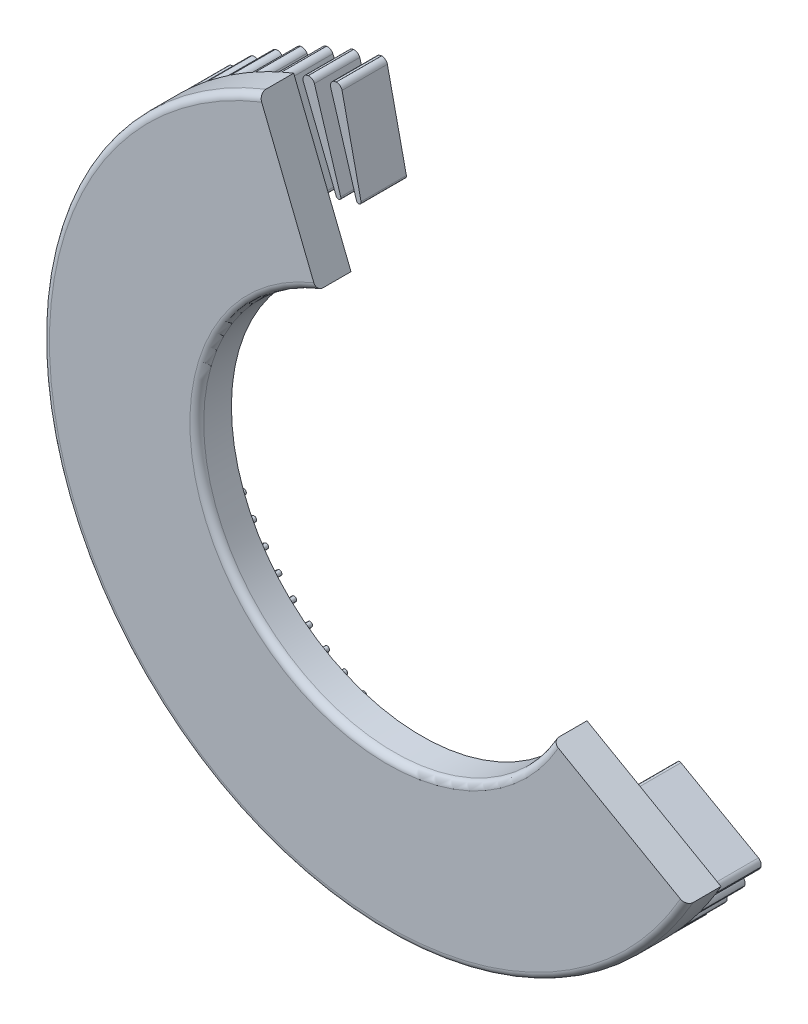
SolidWorks part; units mm, degrees
ref_plane "Přední rovina" through (0, 0, 0) normal (0, 0, 1) x (1, 0, 0)
ref_plane "Horní rovina" through (0, 0, 0) normal (0, 1, 0) x (1, 0, 0)
ref_plane "Pravá rovina" through (0, 0, 0) normal (1, 0, 0) x (0, 0, -1)
sketch "Skica1" plane through (0, 0, 0) normal (0, 0, 1) x (1, 0, 0)
  line L0 (-0.0007, 94.0554) -> (-0.0007, -97.5291) construction
  line L1 (-111.4898, -0.3887) -> (131.9321, -0.3887) construction
  line L2 (-0.0007, 77.5113) -> (-0.0007, 75.9876)
  line L3 (-0.3207, 75.9876) -> (0.3193, 75.9876)
  line L4 (0.3193, 75.9876) -> (0.3193, 75.9776)
  line L5 (-0.0007, 76.1476) -> (-0.0007, 74.7176)
  line L6 (-0.0007, 74.7176) -> (-0.0007, 55.1176)
  line L7 (1.2993, 74.7176) -> (0.5293, 55.1176)
  line L8 (-1.3007, 74.7176) -> (-0.5307, 55.1176)
  line L9 (-0.3207, 75.9876) -> (-0.3207, 75.9776)
  line L10 (5.0405, 74.5587) -> (4.1455, 54.964)
  line L11 (7.6311, 74.3382) -> (5.2017, 54.8742)
  line L12 (6.7624, 75.6868) -> (6.7615, 75.6768)
  line L13 (6.1247, 75.7411) -> (6.1238, 75.7311)
  line L14 (6.1247, 75.7411) -> (6.7624, 75.6868)
  line L15 (11.3454, 73.8627) -> (8.7919, 54.4145)
  line L16 (13.908, 73.4233) -> (9.8366, 54.2353)
  line L17 (13.1567, 74.8406) -> (13.155, 74.8308)
  line L18 (12.5259, 74.9488) -> (12.5242, 74.9389)
  line L19 (12.5259, 74.9488) -> (13.1567, 74.8406)
  line L20 (17.5685, 72.6344) -> (13.3749, 53.4728)
  line L21 (20.0846, 71.9793) -> (14.4007, 53.2057)
  line L22 (19.4562, 73.4552) -> (19.4537, 73.4456)
  line L23 (18.8369, 73.6165) -> (18.8344, 73.6068)
  line L24 (18.8369, 73.6165) -> (19.4562, 73.4552)
  line L25 (23.665, 70.8829) -> (17.8615, 52.1459)
  line L26 (26.1165, 70.0167) -> (18.861, 51.7928)
  line L27 (25.6156, 71.5406) -> (25.6123, 71.5312)
  line L28 (25.0121, 71.7538) -> (25.0088, 71.7444)
  line L29 (25.0121, 71.7538) -> (25.6156, 71.5406)
  line L30 (29.5911, 68.6206) -> (22.2194, 50.4433)
  line L31 (31.9603, 67.5496) -> (23.1854, 50.0067)
  line L32 (31.5904, 69.1105) -> (31.5863, 69.1014)
  line L33 (31.0072, 69.3742) -> (31.0031, 69.365)
  line L34 (31.0072, 69.3742) -> (31.5904, 69.1105)
  line L35 (35.3039, 65.8639) -> (26.4173, 48.3773)
  line L36 (37.5737, 64.5958) -> (27.3427, 47.8603)
  line L37 (37.3376, 66.1825) -> (37.3327, 66.1738)
  line L38 (36.7788, 66.4946) -> (36.7739, 66.4859)
  line L39 (36.7788, 66.4946) -> (37.3376, 66.1825)
  line L40 (40.7624, 62.6326) -> (30.4248, 45.9626)
  line L41 (42.9165, 61.1767) -> (31.303, 45.3691)
  line L42 (42.8157, 62.7776) -> (42.8101, 62.7694)
  line L43 (42.2855, 63.136) -> (42.2799, 63.1277)
  line L44 (42.2855, 63.136) -> (42.8157, 62.7776)
  line L45 (45.9271, 58.9501) -> (34.2131, 43.2168)
  line L46 (47.95, 57.3167) -> (35.0378, 42.5509)
  line L47 (47.9854, 58.9205) -> (47.9791, 58.9127)
  line L48 (47.4874, 59.3225) -> (47.4812, 59.3147)
  line L49 (47.4874, 59.3225) -> (47.9854, 58.9205)
  line L50 (50.761, 54.8428) -> (37.7549, 40.1597)
  line L51 (52.6381, 53.0438) -> (38.5202, 39.4262)
  line L52 (52.8093, 54.6388) -> (52.8024, 54.6315)
  line L53 (52.3473, 55.0816) -> (52.3403, 55.0744)
  line L54 (52.3473, 55.0816) -> (52.8093, 54.6388)
  line L55 (55.2291, 50.3404) -> (41.0247, 36.8132)
  line L56 (56.9469, 48.3887) -> (41.725, 36.0175)
  line L57 (57.2528, 49.9634) -> (57.2453, 49.9568)
  line L58 (56.8299, 50.4438) -> (56.8224, 50.4372)
  line L59 (56.8299, 50.4438) -> (57.2528, 49.9634)
  line L60 (59.2993, 45.4753) -> (43.9988, 33.2014)
  line L61 (60.8454, 43.3849) -> (44.6292, 32.3492)
  line L62 (61.2837, 44.928) -> (61.2757, 44.9221)
  line L63 (60.9031, 45.4426) -> (60.8951, 45.4366)
  line L64 (60.9031, 45.4426) -> (61.2837, 44.928)
  line L65 (62.9423, 40.2825) -> (46.656, 29.3504)
  line L66 (64.3055, 38.0686) -> (47.2118, 28.4478)
  line L67 (64.8731, 39.5689) -> (64.8646, 39.5637)
  line L68 (64.5375, 40.1139) -> (64.529, 40.1087)
  line L69 (64.5375, 40.1139) -> (64.8731, 39.5689)
  line L70 (66.1317, 34.7995) -> (48.977, 25.288)
  line L71 (67.3022, 32.4779) -> (49.4542, 24.3415)
  line L72 (67.9951, 33.9248) -> (67.9861, 33.9203)
  line L73 (67.7069, 34.4962) -> (67.698, 34.4917)
  line L74 (67.7069, 34.4962) -> (67.9951, 33.9248)
  line L75 (68.8447, 29.0658) -> (50.9452, 21.0434)
  line L76 (69.8141, 26.6533) -> (51.3404, 20.0598)
  line L77 (70.6271, 28.0362) -> (70.6179, 28.0324)
  line L78 (70.3885, 28.63) -> (70.3792, 28.6263)
  line L79 (70.3885, 28.63) -> (70.6271, 28.0362)
  line L80 (71.0616, 23.1227) -> (52.5462, 16.6471)
  line L81 (71.823, 20.6366) -> (52.8566, 15.6336)
  line L82 (72.7503, 21.9456) -> (72.7408, 21.9426)
  line L83 (72.5629, 22.5575) -> (72.5534, 22.5546)
  line L84 (72.5629, 22.5575) -> (72.7503, 21.9456)
  line L85 (72.7666, 17.0129) -> (53.7687, 12.1309)
  line L86 (73.3143, 14.4713) -> (53.992, 11.0947)
  line L87 (74.3494, 15.6969) -> (74.3396, 15.6947)
  line L88 (74.2145, 16.3225) -> (74.2047, 16.3204)
  line L89 (74.2145, 16.3225) -> (74.3494, 15.6969)
  line L90 (73.9472, 10.7806) -> (54.6038, 7.5273)
  line L91 (74.2775, 8.2017) -> (54.7384, 6.4759)
  line L92 (75.4127, 9.335) -> (75.4028, 9.3338)
  line L93 (75.3314, 9.9699) -> (75.3215, 9.9686)
  line L94 (75.3314, 9.9699) -> (75.4127, 9.335)
  line L95 (74.5951, 4.4706) -> (55.0454, 2.8695)
  line L96 (74.7054, 1.8729) -> (55.0904, 1.8104)
  line L97 (75.9327, 2.906) -> (75.9227, 2.9055)
  line L98 (75.9055, 3.5454) -> (75.8955, 3.545)
  line L99 (75.9055, 3.5454) -> (75.9327, 2.906)
  line L100 (74.7055, -1.8716) -> (55.0905, -1.8091)
  line L101 (74.5951, -4.4693) -> (55.0455, -2.8681)
  line L102 (75.9056, -3.544) -> (75.8956, -3.5436)
  line L103 (75.9327, -2.9046) -> (75.9228, -2.9042)
  line L104 (75.9327, -2.9046) -> (75.9056, -3.544)
  line L105 (74.2776, -8.2003) -> (54.7386, -6.4745)
  line L106 (73.9474, -10.7793) -> (54.6039, -7.526)
  line L107 (75.3316, -9.9685) -> (75.3217, -9.9673)
  line L108 (75.4129, -9.3337) -> (75.403, -9.3324)
  line L109 (75.4129, -9.3337) -> (75.3316, -9.9685)
  line L110 (73.3146, -14.47) -> (53.9923, -11.0934)
  line L111 (72.7668, -17.0116) -> (53.769, -12.1296)
  line L112 (74.2148, -16.3212) -> (74.205, -16.3191)
  line L113 (74.3496, -15.6955) -> (74.3399, -15.6934)
  line L114 (74.3496, -15.6955) -> (74.2148, -16.3212)
  line L115 (71.8234, -20.6354) -> (52.857, -15.6323)
  line L116 (71.062, -23.1214) -> (52.5466, -16.6458)
  line L117 (72.5633, -22.5562) -> (72.5538, -22.5533)
  line L118 (72.7507, -21.9443) -> (72.7412, -21.9414)
  line L119 (72.7507, -21.9443) -> (72.5633, -22.5562)
  line L120 (69.8146, -26.6521) -> (51.3409, -20.0586)
  line L121 (68.8452, -29.0646) -> (50.9457, -21.0421)
  line L122 (70.389, -28.6288) -> (70.3797, -28.625)
  line L123 (70.6276, -28.0349) -> (70.6184, -28.0312)
  line L124 (70.6276, -28.0349) -> (70.389, -28.6288)
  line L125 (67.3029, -32.4767) -> (49.4548, -24.3403)
  line L126 (66.1323, -34.7984) -> (48.9776, -25.2868)
  line L127 (67.7075, -34.495) -> (67.6986, -34.4905)
  line L128 (67.9957, -33.9236) -> (67.9867, -33.9191)
  line L129 (67.9957, -33.9236) -> (67.7075, -34.495)
  line L130 (64.3062, -38.0674) -> (47.2125, -28.4467)
  line L131 (62.943, -40.2814) -> (46.6567, -29.3493)
  line L132 (64.5382, -40.1128) -> (64.5297, -40.1075)
  line L133 (64.8738, -39.5678) -> (64.8653, -39.5626)
  line L134 (64.8738, -39.5678) -> (64.5382, -40.1128)
  line L135 (60.8462, -43.3838) -> (44.63, -32.3481)
  line L136 (59.3001, -45.4742) -> (43.9996, -33.2003)
  line L137 (60.9039, -45.4415) -> (60.8959, -45.4355)
  line L138 (61.2845, -44.9269) -> (61.2765, -44.921)
  line L139 (61.2845, -44.9269) -> (60.9039, -45.4415)
  line L140 (56.9478, -48.3877) -> (41.7259, -36.0165)
  line L141 (55.23, -50.3394) -> (41.0255, -36.8122)
  line L142 (56.8308, -50.4428) -> (56.8233, -50.4362)
  line L143 (57.2537, -49.9624) -> (57.2461, -49.9558)
  line L144 (57.2537, -49.9624) -> (56.8308, -50.4428)
  line L145 (52.639, -53.0428) -> (38.5211, -39.4253)
  line L146 (50.762, -54.8419) -> (37.7559, -40.1588)
  line L147 (52.3482, -55.0807) -> (52.3413, -55.0735)
  line L148 (52.8103, -54.6378) -> (52.8034, -54.6306)
  line L149 (52.8103, -54.6378) -> (52.3482, -55.0807)
  line L150 (47.9511, -57.3159) -> (35.0389, -42.5501)
  line L151 (45.9282, -58.9492) -> (34.2141, -43.216)
  line L152 (47.4885, -59.3217) -> (47.4822, -59.3139)
  line L153 (47.9864, -58.9196) -> (47.9801, -58.9118)
  line L154 (47.9864, -58.9196) -> (47.4885, -59.3217)
  line L155 (42.9176, -61.1759) -> (31.3041, -45.3683)
  line L156 (40.7635, -62.6319) -> (30.4259, -45.9619)
  line L157 (42.2866, -63.1353) -> (42.281, -63.127)
  line L158 (42.8168, -62.7769) -> (42.8112, -62.7686)
  line L159 (42.8168, -62.7769) -> (42.2866, -63.1353)
  line L160 (37.5749, -64.5952) -> (27.3439, -47.8596)
  line L161 (35.3051, -65.8632) -> (26.4185, -48.3766)
  line L162 (36.78, -66.494) -> (36.7751, -66.4853)
  line L163 (37.3387, -66.1819) -> (37.3338, -66.1731)
  line L164 (37.3387, -66.1819) -> (36.78, -66.494)
  line L165 (31.9615, -67.5491) -> (23.1866, -50.0062)
  line L166 (29.5923, -68.62) -> (22.2207, -50.4428)
  line L167 (31.0084, -69.3736) -> (31.0043, -69.3645)
  line L168 (31.5916, -69.11) -> (31.5875, -69.1009)
  line L169 (31.5916, -69.11) -> (31.0084, -69.3736)
  line L170 (26.1178, -70.0162) -> (18.8622, -51.7924)
  line L171 (23.6663, -70.8824) -> (17.8628, -52.1455)
  line L172 (25.0134, -71.7534) -> (25.0101, -71.744)
  line L173 (25.6168, -71.5402) -> (25.6135, -71.5307)
  line L174 (25.6168, -71.5402) -> (25.0134, -71.7534)
  line L175 (20.0859, -71.9789) -> (14.402, -53.2054)
  line L176 (17.5698, -72.6341) -> (13.3762, -53.4725)
  line L177 (18.8382, -73.6162) -> (18.8357, -73.6065)
  line L178 (19.4575, -73.4549) -> (19.455, -73.4452)
  line L179 (19.4575, -73.4549) -> (18.8382, -73.6162)
  line L180 (13.9093, -73.423) -> (9.838, -54.2351)
  line L181 (11.3467, -73.8625) -> (8.7932, -54.4142)
  line L182 (12.5272, -74.9486) -> (12.5255, -74.9387)
  line L183 (13.158, -74.8404) -> (13.1563, -74.8305)
  line L184 (13.158, -74.8404) -> (12.5272, -74.9486)
  line L185 (7.6325, -74.3381) -> (5.2031, -54.874)
  line L186 (5.0418, -74.5586) -> (4.1469, -54.9639)
  line L187 (6.126, -75.7409) -> (6.1252, -75.731)
  line L188 (6.7637, -75.6867) -> (6.7629, -75.6767)
  line L189 (6.7637, -75.6867) -> (6.126, -75.7409)
  line L190 (1.3007, -74.7176) -> (0.5307, -55.1176)
  line L191 (-1.2993, -74.7176) -> (-0.5293, -55.1176)
  line L192 (-0.3193, -75.9876) -> (-0.3193, -75.9776)
  line L193 (0.3207, -75.9876) -> (0.3207, -75.9776)
  line L194 (0.3207, -75.9876) -> (-0.3193, -75.9876)
  line L195 (-5.0405, -74.5587) -> (-4.1455, -54.964)
  line L196 (-7.6311, -74.3382) -> (-5.2017, -54.8742)
  line L197 (-6.7624, -75.6868) -> (-6.7615, -75.6768)
  line L198 (-6.1247, -75.7411) -> (-6.1238, -75.7311)
  line L199 (-6.1247, -75.7411) -> (-6.7624, -75.6868)
  line L200 (-11.3454, -73.8627) -> (-8.7919, -54.4145)
  line L201 (-13.908, -73.4233) -> (-9.8366, -54.2353)
  line L202 (-13.1567, -74.8406) -> (-13.155, -74.8308)
  line L203 (-12.5259, -74.9488) -> (-12.5242, -74.9389)
  line L204 (-12.5259, -74.9488) -> (-13.1567, -74.8406)
  line L205 (-17.5685, -72.6344) -> (-13.3749, -53.4728)
  line L206 (-20.0846, -71.9793) -> (-14.4007, -53.2057)
  line L207 (-19.4562, -73.4552) -> (-19.4537, -73.4456)
  line L208 (-18.8369, -73.6165) -> (-18.8344, -73.6068)
  line L209 (-18.8369, -73.6165) -> (-19.4562, -73.4552)
  line L210 (-23.665, -70.8829) -> (-17.8615, -52.1459)
  line L211 (-26.1165, -70.0167) -> (-18.861, -51.7928)
  line L212 (-25.6156, -71.5406) -> (-25.6123, -71.5312)
  line L213 (-25.0121, -71.7538) -> (-25.0088, -71.7444)
  line L214 (-25.0121, -71.7538) -> (-25.6156, -71.5406)
  line L215 (-29.5911, -68.6206) -> (-22.2194, -50.4433)
  line L216 (-31.9603, -67.5496) -> (-23.1854, -50.0067)
  line L217 (-31.5904, -69.1105) -> (-31.5863, -69.1014)
  line L218 (-31.0072, -69.3742) -> (-31.0031, -69.365)
  line L219 (-31.0072, -69.3742) -> (-31.5904, -69.1105)
  line L220 (-35.3039, -65.8639) -> (-26.4173, -48.3773)
  line L221 (-37.5737, -64.5958) -> (-27.3427, -47.8603)
  line L222 (-37.3376, -66.1825) -> (-37.3327, -66.1738)
  line L223 (-36.7788, -66.4946) -> (-36.7739, -66.4859)
  line L224 (-36.7788, -66.4946) -> (-37.3376, -66.1825)
  line L225 (-40.7624, -62.6326) -> (-30.4248, -45.9626)
  line L226 (-42.9165, -61.1767) -> (-31.303, -45.3691)
  line L227 (-42.8157, -62.7776) -> (-42.8101, -62.7694)
  line L228 (-42.2855, -63.136) -> (-42.2799, -63.1277)
  line L229 (-42.2855, -63.136) -> (-42.8157, -62.7776)
  line L230 (-45.9271, -58.9501) -> (-34.2131, -43.2168)
  line L231 (-47.95, -57.3167) -> (-35.0378, -42.5509)
  line L232 (-47.9854, -58.9205) -> (-47.9791, -58.9127)
  line L233 (-47.4874, -59.3225) -> (-47.4812, -59.3147)
  line L234 (-47.4874, -59.3225) -> (-47.9854, -58.9205)
  line L235 (-50.761, -54.8428) -> (-37.7549, -40.1597)
  line L236 (-52.6381, -53.0438) -> (-38.5202, -39.4262)
  line L237 (-52.8093, -54.6388) -> (-52.8024, -54.6315)
  line L238 (-52.3473, -55.0816) -> (-52.3403, -55.0744)
  line L239 (-52.3473, -55.0816) -> (-52.8093, -54.6388)
  line L240 (-55.2291, -50.3404) -> (-41.0247, -36.8132)
  line L241 (-56.9469, -48.3887) -> (-41.725, -36.0175)
  line L242 (-57.2528, -49.9634) -> (-57.2453, -49.9568)
  line L243 (-56.8299, -50.4438) -> (-56.8224, -50.4372)
  line L244 (-56.8299, -50.4438) -> (-57.2528, -49.9634)
  line L245 (-59.2993, -45.4753) -> (-43.9988, -33.2014)
  line L246 (-60.8454, -43.3849) -> (-44.6292, -32.3492)
  line L247 (-61.2837, -44.928) -> (-61.2757, -44.9221)
  line L248 (-60.9031, -45.4426) -> (-60.8951, -45.4366)
  line L249 (-60.9031, -45.4426) -> (-61.2837, -44.928)
  line L250 (-62.9423, -40.2825) -> (-46.656, -29.3504)
  line L251 (-64.3055, -38.0686) -> (-47.2118, -28.4478)
  line L252 (-64.8731, -39.5689) -> (-64.8646, -39.5637)
  line L253 (-64.5375, -40.1139) -> (-64.529, -40.1087)
  line L254 (-64.5375, -40.1139) -> (-64.8731, -39.5689)
  line L255 (-66.1317, -34.7995) -> (-48.977, -25.288)
  line L256 (-67.3022, -32.4779) -> (-49.4542, -24.3415)
  line L257 (-67.9951, -33.9248) -> (-67.9861, -33.9203)
  line L258 (-67.7069, -34.4962) -> (-67.698, -34.4917)
  line L259 (-67.7069, -34.4962) -> (-67.9951, -33.9248)
  line L260 (-68.8447, -29.0658) -> (-50.9452, -21.0434)
  line L261 (-69.8141, -26.6533) -> (-51.3404, -20.0598)
  line L262 (-70.6271, -28.0362) -> (-70.6179, -28.0324)
  line L263 (-70.3885, -28.63) -> (-70.3792, -28.6263)
  line L264 (-70.3885, -28.63) -> (-70.6271, -28.0362)
  line L265 (-71.0616, -23.1227) -> (-52.5462, -16.6471)
  line L266 (-71.823, -20.6366) -> (-52.8566, -15.6336)
  line L267 (-72.7503, -21.9456) -> (-72.7408, -21.9426)
  line L268 (-72.5629, -22.5575) -> (-72.5534, -22.5546)
  line L269 (-72.5629, -22.5575) -> (-72.7503, -21.9456)
  line L270 (-72.7666, -17.0129) -> (-53.7687, -12.1309)
  line L271 (-73.3143, -14.4713) -> (-53.992, -11.0947)
  line L272 (-74.3494, -15.6969) -> (-74.3396, -15.6947)
  line L273 (-74.2145, -16.3225) -> (-74.2047, -16.3204)
  line L274 (-74.2145, -16.3225) -> (-74.3494, -15.6969)
  line L275 (-73.9472, -10.7806) -> (-54.6038, -7.5273)
  line L276 (-74.2775, -8.2017) -> (-54.7384, -6.4759)
  line L277 (-75.4127, -9.335) -> (-75.4028, -9.3338)
  line L278 (-75.3314, -9.9699) -> (-75.3215, -9.9686)
  line L279 (-75.3314, -9.9699) -> (-75.4127, -9.335)
  line L280 (-74.5951, -4.4706) -> (-55.0454, -2.8695)
  line L281 (-74.7054, -1.8729) -> (-55.0904, -1.8104)
  line L282 (-75.9327, -2.906) -> (-75.9227, -2.9055)
  line L283 (-75.9055, -3.5454) -> (-75.8955, -3.545)
  line L284 (-75.9055, -3.5454) -> (-75.9327, -2.906)
  line L285 (-74.7055, 1.8716) -> (-55.0905, 1.8091)
  line L286 (-74.5951, 4.4693) -> (-55.0455, 2.8681)
  line L287 (-75.9056, 3.544) -> (-75.8956, 3.5436)
  line L288 (-75.9327, 2.9046) -> (-75.9228, 2.9042)
  line L289 (-75.9327, 2.9046) -> (-75.9056, 3.544)
  line L290 (-74.2776, 8.2003) -> (-54.7386, 6.4745)
  line L291 (-73.9474, 10.7793) -> (-54.6039, 7.526)
  line L292 (-75.3316, 9.9685) -> (-75.3217, 9.9673)
  line L293 (-75.4129, 9.3337) -> (-75.403, 9.3324)
  line L294 (-75.4129, 9.3337) -> (-75.3316, 9.9685)
  line L295 (-73.3146, 14.47) -> (-53.9923, 11.0934)
  line L296 (-72.7668, 17.0116) -> (-53.769, 12.1296)
  line L297 (-74.2148, 16.3212) -> (-74.205, 16.3191)
  line L298 (-74.3496, 15.6955) -> (-74.3399, 15.6934)
  line L299 (-74.3496, 15.6955) -> (-74.2148, 16.3212)
  line L300 (-71.8234, 20.6354) -> (-52.857, 15.6323)
  line L301 (-71.062, 23.1214) -> (-52.5466, 16.6458)
  line L302 (-72.5633, 22.5562) -> (-72.5538, 22.5533)
  line L303 (-72.7507, 21.9443) -> (-72.7412, 21.9414)
  line L304 (-72.7507, 21.9443) -> (-72.5633, 22.5562)
  line L305 (-69.8146, 26.6521) -> (-51.3409, 20.0586)
  line L306 (-68.8452, 29.0646) -> (-50.9457, 21.0421)
  line L307 (-70.389, 28.6288) -> (-70.3797, 28.625)
  line L308 (-70.6276, 28.0349) -> (-70.6184, 28.0312)
  line L309 (-70.6276, 28.0349) -> (-70.389, 28.6288)
  line L310 (-67.3029, 32.4767) -> (-49.4548, 24.3403)
  line L311 (-66.1323, 34.7984) -> (-48.9776, 25.2868)
  line L312 (-67.7075, 34.495) -> (-67.6986, 34.4905)
  line L313 (-67.9957, 33.9236) -> (-67.9867, 33.9191)
  line L314 (-67.9957, 33.9236) -> (-67.7075, 34.495)
  line L315 (-64.3062, 38.0674) -> (-47.2125, 28.4467)
  line L316 (-62.943, 40.2814) -> (-46.6567, 29.3493)
  line L317 (-64.5382, 40.1128) -> (-64.5297, 40.1075)
  line L318 (-64.8738, 39.5678) -> (-64.8653, 39.5626)
  line L319 (-64.8738, 39.5678) -> (-64.5382, 40.1128)
  line L320 (-60.8462, 43.3838) -> (-44.63, 32.3481)
  line L321 (-59.3001, 45.4742) -> (-43.9996, 33.2003)
  line L322 (-60.9039, 45.4415) -> (-60.8959, 45.4355)
  line L323 (-61.2845, 44.9269) -> (-61.2765, 44.921)
  line L324 (-61.2845, 44.9269) -> (-60.9039, 45.4415)
  line L325 (-56.9478, 48.3877) -> (-41.7259, 36.0165)
  line L326 (-55.23, 50.3394) -> (-41.0255, 36.8122)
  line L327 (-56.8308, 50.4428) -> (-56.8233, 50.4362)
  line L328 (-57.2537, 49.9624) -> (-57.2461, 49.9558)
  line L329 (-57.2537, 49.9624) -> (-56.8308, 50.4428)
  line L330 (-52.639, 53.0428) -> (-38.5211, 39.4253)
  line L331 (-50.762, 54.8419) -> (-37.7559, 40.1588)
  line L332 (-52.3482, 55.0807) -> (-52.3413, 55.0735)
  line L333 (-52.8103, 54.6378) -> (-52.8034, 54.6306)
  line L334 (-52.8103, 54.6378) -> (-52.3482, 55.0807)
  line L335 (-47.9511, 57.3159) -> (-35.0389, 42.5501)
  line L336 (-45.9282, 58.9492) -> (-34.2141, 43.216)
  line L337 (-47.4885, 59.3217) -> (-47.4822, 59.3139)
  line L338 (-47.9864, 58.9196) -> (-47.9801, 58.9118)
  line L339 (-47.9864, 58.9196) -> (-47.4885, 59.3217)
  line L340 (-42.9176, 61.1759) -> (-31.3041, 45.3683)
  line L341 (-40.7635, 62.6319) -> (-30.4259, 45.9619)
  line L342 (-42.2866, 63.1353) -> (-42.281, 63.127)
  line L343 (-42.8168, 62.7769) -> (-42.8112, 62.7686)
  line L344 (-42.8168, 62.7769) -> (-42.2866, 63.1353)
  line L345 (-37.5749, 64.5952) -> (-27.3439, 47.8596)
  line L346 (-35.3051, 65.8632) -> (-26.4185, 48.3766)
  line L347 (-36.78, 66.494) -> (-36.7751, 66.4853)
  line L348 (-37.3387, 66.1819) -> (-37.3338, 66.1731)
  line L349 (-37.3387, 66.1819) -> (-36.78, 66.494)
  line L350 (-31.9615, 67.5491) -> (-23.1866, 50.0062)
  line L351 (-29.5923, 68.62) -> (-22.2207, 50.4428)
  line L352 (-31.0084, 69.3736) -> (-31.0043, 69.3645)
  line L353 (-31.5916, 69.11) -> (-31.5875, 69.1009)
  line L354 (-31.5916, 69.11) -> (-31.0084, 69.3736)
  line L355 (-26.1178, 70.0162) -> (-18.8622, 51.7924)
  line L356 (-23.6663, 70.8824) -> (-17.8628, 52.1455)
  line L357 (-25.0134, 71.7534) -> (-25.0101, 71.744)
  line L358 (-25.6168, 71.5402) -> (-25.6135, 71.5307)
  line L359 (-25.6168, 71.5402) -> (-25.0134, 71.7534)
  line L360 (-20.0859, 71.9789) -> (-14.402, 53.2054)
  line L361 (-17.5698, 72.6341) -> (-13.3762, 53.4725)
  line L362 (-18.8382, 73.6162) -> (-18.8357, 73.6065)
  line L363 (-19.4575, 73.4549) -> (-19.455, 73.4452)
  line L364 (-19.4575, 73.4549) -> (-18.8382, 73.6162)
  line L365 (-13.9093, 73.423) -> (-9.838, 54.2351)
  line L366 (-11.3467, 73.8625) -> (-8.7932, 54.4142)
  line L367 (-12.5272, 74.9486) -> (-12.5255, 74.9387)
  line L368 (-13.158, 74.8404) -> (-13.1563, 74.8305)
  line L369 (-13.158, 74.8404) -> (-12.5272, 74.9486)
  line L370 (-7.6325, 74.3381) -> (-5.2031, 54.874)
  line L371 (-5.0418, 74.5586) -> (-4.1469, 54.9639)
  line L372 (-6.126, 75.7409) -> (-6.1252, 75.731)
  line L373 (-6.7637, 75.6867) -> (-6.7629, 75.6767)
  line L374 (-6.7637, 75.6867) -> (-6.126, 75.7409)
  circle A0 centre (-0.0007, -0.3887) radius 25
  circle A1 centre (-0.0007, -0.3887) radius 77.9
  arc A2 (1.2953, 74.6156) -> (0.3193, 75.9776) centre (-0.0007, 74.7176) ccw
  arc A3 (-0.5307, 55.1176) -> (0.5293, 55.1176) centre (-0.0007, 55.1176) ccw
  arc A4 (-0.3207, 75.9776) -> (-1.2967, 74.6156) centre (-0.0007, 74.7176) ccw
  arc A5 (4.1455, 54.964) -> (5.2017, 54.8742) centre (4.6736, 54.9191) ccw
  arc A6 (6.1238, 75.7311) -> (5.0359, 74.4568) centre (6.3358, 74.4485) ccw
  arc A7 (7.6185, 74.237) -> (6.7615, 75.6768) centre (6.3358, 74.4485) ccw
  arc A8 (8.7919, 54.4145) -> (9.8366, 54.2353) centre (9.3143, 54.3249) ccw
  arc A9 (12.5242, 74.9389) -> (11.3321, 73.7615) centre (12.6267, 73.643) ccw
  arc A10 (13.8868, 73.3234) -> (13.155, 74.8308) centre (12.6267, 73.643) ccw
  arc A11 (13.3749, 53.4728) -> (14.4007, 53.2057) centre (13.8878, 53.3393) ccw
  arc A12 (18.8344, 73.6068) -> (17.5467, 72.5347) centre (18.8265, 72.3069) ccw
  arc A13 (20.055, 71.8816) -> (19.4537, 73.4456) centre (18.8265, 72.3069) ccw
  arc A14 (17.8615, 52.1459) -> (18.861, 51.7928) centre (18.3612, 51.9694) ccw
  arc A15 (25.0088, 71.7444) -> (23.6348, 70.7854) centre (24.8908, 70.4498) ccw
  arc A16 (26.0788, 69.9219) -> (25.6123, 71.5312) centre (24.8908, 70.4498) ccw
  arc A17 (22.2194, 50.4433) -> (23.1854, 50.0067) centre (22.7024, 50.225) ccw
  arc A18 (31.0031, 69.365) -> (29.5527, 68.526) centre (30.7757, 68.0851) ccw
  arc A19 (31.9146, 67.4583) -> (31.5863, 69.1014) centre (30.7757, 68.0851) ccw
  arc A20 (26.4173, 48.3773) -> (27.3427, 47.8603) centre (26.88, 48.1188) ccw
  arc A21 (36.7739, 66.4859) -> (35.2577, 65.7729) centre (36.4388, 65.2299) ccw
  arc A22 (37.5205, 64.5088) -> (37.3327, 66.1738) centre (36.4388, 65.2299) ccw
  arc A23 (30.4248, 45.9626) -> (31.303, 45.3691) centre (30.8639, 45.6658) ccw
  arc A24 (42.2799, 63.1277) -> (40.7086, 62.5459) centre (41.8394, 61.9046) ccw
  arc A25 (42.8561, 61.0944) -> (42.8101, 62.7694) centre (41.8394, 61.9046) ccw
  arc A26 (34.2131, 43.2168) -> (35.0378, 42.5509) centre (34.6255, 42.8839) ccw
  arc A27 (47.4812, 59.3147) -> (45.8662, 58.8682) centre (46.9386, 58.1334) ccw
  arc A28 (47.8828, 57.2399) -> (47.9791, 58.9127) centre (46.9386, 58.1334) ccw
  arc A29 (37.7549, 40.1597) -> (38.5202, 39.4262) centre (38.1375, 39.793) ccw
  arc A30 (52.3403, 55.0744) -> (50.6933, 54.7664) centre (51.6995, 53.9433) ccw
  arc A31 (52.5646, 52.9729) -> (52.8024, 54.6315) centre (51.6995, 53.9433) ccw
  arc A32 (41.0247, 36.8132) -> (41.725, 36.0175) centre (41.3748, 36.4153) ccw
  arc A33 (56.8224, 50.4372) -> (55.1552, 50.27) centre (56.088, 49.3645) ccw
  arc A34 (56.8677, 48.3243) -> (57.2453, 49.9568) centre (56.088, 49.3645) ccw
  arc A35 (43.9988, 33.2014) -> (44.6292, 32.3492) centre (44.314, 32.7753) ccw
  arc A36 (60.8951, 45.4366) -> (59.2197, 45.4114) centre (60.0723, 44.4301) ccw
  arc A37 (60.761, 43.3275) -> (61.2757, 44.9221) centre (60.0723, 44.4301) ccw
  arc A38 (46.656, 29.3504) -> (47.2118, 28.4478) centre (46.9339, 28.8991) ccw
  arc A39 (64.529, 40.1087) -> (62.8575, 40.2257) centre (63.6239, 39.1756) ccw
  arc A40 (64.2165, 38.0185) -> (64.8646, 39.5637) centre (63.6239, 39.1756) ccw
  arc A41 (48.977, 25.288) -> (49.4542, 24.3415) centre (49.2156, 24.8148) ccw
  arc A42 (67.698, 34.4917) -> (66.0425, 34.7501) centre (66.717, 33.6387) ccw
  arc A43 (67.2094, 32.4356) -> (67.9861, 33.9203) centre (66.717, 33.6387) ccw
  arc A44 (50.9452, 21.0434) -> (51.3404, 20.0598) centre (51.1428, 20.5516) ccw
  arc A45 (70.3792, 28.6263) -> (68.7515, 29.0241) centre (69.3294, 27.8596) ccw
  arc A46 (69.718, 26.619) -> (70.6179, 28.0324) centre (69.3294, 27.8596) ccw
  arc A47 (52.5462, 16.6471) -> (52.8566, 15.6336) centre (52.7014, 16.1403) ccw
  arc A48 (72.5534, 22.5546) -> (70.9653, 23.089) centre (71.4423, 21.8797) ccw
  arc A49 (71.7243, 20.6106) -> (72.7408, 21.9426) centre (71.4423, 21.8797) ccw
  arc A50 (53.7687, 12.1309) -> (53.992, 11.0947) centre (53.8804, 11.6128) ccw
  arc A51 (74.2047, 16.3204) -> (72.6677, 16.9875) centre (73.0404, 15.7421) ccw
  arc A52 (73.2138, 14.4537) -> (74.3396, 15.6947) centre (73.0404, 15.7421) ccw
  arc A53 (54.6038, 7.5273) -> (54.7384, 6.4759) centre (54.6711, 7.0016) ccw
  arc A54 (75.3215, 9.9686) -> (73.8466, 10.7637) centre (74.1123, 9.4911) ccw
  arc A55 (74.1758, 8.1927) -> (75.4028, 9.3338) centre (74.1123, 9.4911) ccw
  arc A56 (55.0454, 2.8695) -> (55.0904, 1.8104) centre (55.0679, 2.3399) ccw
  arc A57 (75.8955, 3.545) -> (74.4934, 4.4623) centre (74.6503, 3.1718) ccw
  arc A58 (74.6034, 1.8726) -> (75.9227, 2.9055) centre (74.6503, 3.1718) ccw
  arc A59 (55.0905, -1.8091) -> (55.0455, -2.8681) centre (55.068, -2.3386) ccw
  arc A60 (75.9228, -2.9042) -> (74.6034, -1.8713) centre (74.6503, -3.1704) ccw
  arc A61 (74.4934, -4.4609) -> (75.8956, -3.5436) centre (74.6503, -3.1704) ccw
  arc A62 (54.7386, -6.4745) -> (54.6039, -7.526) centre (54.6713, -7.0003) ccw
  arc A63 (75.403, -9.3324) -> (74.176, -8.1914) centre (74.1125, -9.4898) ccw
  arc A64 (73.8467, -10.7623) -> (75.3217, -9.9673) centre (74.1125, -9.4898) ccw
  arc A65 (53.9923, -11.0934) -> (53.769, -12.1296) centre (53.8806, -11.6115) ccw
  arc A66 (74.3399, -15.6934) -> (73.2141, -14.4524) centre (73.0407, -15.7408) ccw
  arc A67 (72.668, -16.9862) -> (74.205, -16.3191) centre (73.0407, -15.7408) ccw
  arc A68 (52.857, -15.6323) -> (52.5466, -16.6458) centre (52.7018, -16.139) ccw
  arc A69 (72.7412, -21.9414) -> (71.7247, -20.6093) centre (71.4427, -21.8784) ccw
  arc A70 (70.9657, -23.0877) -> (72.5538, -22.5533) centre (71.4427, -21.8784) ccw
  arc A71 (51.3409, -20.0586) -> (50.9457, -21.0421) centre (51.1433, -20.5503) ccw
  arc A72 (70.6184, -28.0312) -> (69.7185, -26.6178) centre (69.3299, -27.8583) ccw
  arc A73 (68.752, -29.0228) -> (70.3797, -28.625) centre (69.3299, -27.8583) ccw
  arc A74 (49.4548, -24.3403) -> (48.9776, -25.2868) centre (49.2162, -24.8136) ccw
  arc A75 (67.9867, -33.9191) -> (67.21, -32.4344) centre (66.7176, -33.6375) ccw
  arc A76 (66.0431, -34.7489) -> (67.6986, -34.4905) centre (66.7176, -33.6375) ccw
  arc A77 (47.2125, -28.4467) -> (46.6567, -29.3493) centre (46.9346, -28.898) ccw
  arc A78 (64.8653, -39.5626) -> (64.2172, -38.0174) centre (63.6246, -39.1744) ccw
  arc A79 (62.8582, -40.2245) -> (64.5297, -40.1075) centre (63.6246, -39.1744) ccw
  arc A80 (44.63, -32.3481) -> (43.9996, -33.2003) centre (44.3148, -32.7742) ccw
  arc A81 (61.2765, -44.921) -> (60.7618, -43.3264) centre (60.0731, -44.429) ccw
  arc A82 (59.2205, -45.4104) -> (60.8959, -45.4355) centre (60.0731, -44.429) ccw
  arc A83 (41.7259, -36.0165) -> (41.0255, -36.8122) centre (41.3757, -36.4143) ccw
  arc A84 (57.2461, -49.9558) -> (56.8686, -48.3233) centre (56.0889, -49.3635) ccw
  arc A85 (55.1561, -50.269) -> (56.8233, -50.4362) centre (56.0889, -49.3635) ccw
  arc A86 (38.5211, -39.4253) -> (37.7559, -40.1588) centre (38.1385, -39.792) ccw
  arc A87 (52.8034, -54.6306) -> (52.5656, -52.972) centre (51.7005, -53.9424) ccw
  arc A88 (50.6943, -54.7655) -> (52.3413, -55.0735) centre (51.7005, -53.9424) ccw
  arc A89 (35.0389, -42.5501) -> (34.2141, -43.216) centre (34.6265, -42.883) ccw
  arc A90 (47.9801, -58.9118) -> (47.8839, -57.239) centre (46.9396, -58.1325) ccw
  arc A91 (45.8672, -58.8674) -> (47.4822, -59.3139) centre (46.9396, -58.1325) ccw
  arc A92 (31.3041, -45.3683) -> (30.4259, -45.9619) centre (30.865, -45.6651) ccw
  arc A93 (42.8112, -62.7686) -> (42.8572, -61.0937) centre (41.8405, -61.9039) ccw
  arc A94 (40.7097, -62.5451) -> (42.281, -63.127) centre (41.8405, -61.9039) ccw
  arc A95 (27.3439, -47.8596) -> (26.4185, -48.3766) centre (26.8812, -48.1181) ccw
  arc A96 (37.3338, -66.1731) -> (37.5217, -64.5081) centre (36.44, -65.2292) ccw
  arc A97 (35.2588, -65.7722) -> (36.7751, -66.4853) centre (36.44, -65.2292) ccw
  arc A98 (23.1866, -50.0062) -> (22.2207, -50.4428) centre (22.7036, -50.2245) ccw
  arc A99 (31.5875, -69.1009) -> (31.9158, -67.4578) centre (30.7769, -68.0845) ccw
  arc A100 (29.5539, -68.5254) -> (31.0043, -69.3645) centre (30.7769, -68.0845) ccw
  arc A101 (18.8622, -51.7924) -> (17.8628, -52.1455) centre (18.3625, -51.9689) ccw
  arc A102 (25.6135, -71.5307) -> (26.08, -69.9214) centre (24.892, -70.4493) ccw
  arc A103 (23.6361, -70.7849) -> (25.0101, -71.744) centre (24.892, -70.4493) ccw
  arc A104 (14.402, -53.2054) -> (13.3762, -53.4725) centre (13.8891, -53.339) ccw
  arc A105 (19.455, -73.4452) -> (20.0563, -71.8813) centre (18.8278, -72.3065) ccw
  arc A106 (17.548, -72.5344) -> (18.8357, -73.6065) centre (18.8278, -72.3065) ccw
  arc A107 (9.838, -54.2351) -> (8.7932, -54.4142) centre (9.3156, -54.3247) ccw
  arc A108 (13.1563, -74.8305) -> (13.8881, -73.3232) centre (12.628, -73.6427) ccw
  arc A109 (11.3334, -73.7613) -> (12.5255, -74.9387) centre (12.628, -73.6427) ccw
  arc A110 (5.2031, -54.874) -> (4.1469, -54.9639) centre (4.675, -54.919) ccw
  arc A111 (6.7629, -75.6767) -> (7.6198, -74.2369) centre (6.3372, -74.4484) ccw
  arc A112 (5.0372, -74.4567) -> (6.1252, -75.731) centre (6.3372, -74.4484) ccw
  arc A113 (0.5307, -55.1176) -> (-0.5293, -55.1176) centre (0.0007, -55.1176) ccw
  arc A114 (0.3207, -75.9776) -> (1.2967, -74.6156) centre (0.0007, -74.7176) ccw
  arc A115 (-1.2953, -74.6156) -> (-0.3193, -75.9776) centre (0.0007, -74.7176) ccw
  arc A116 (-4.1455, -54.964) -> (-5.2017, -54.8742) centre (-4.6736, -54.9191) ccw
  arc A117 (-6.1238, -75.7311) -> (-5.0359, -74.4568) centre (-6.3358, -74.4485) ccw
  arc A118 (-7.6185, -74.237) -> (-6.7615, -75.6768) centre (-6.3358, -74.4485) ccw
  arc A119 (-8.7919, -54.4145) -> (-9.8366, -54.2353) centre (-9.3143, -54.3249) ccw
  arc A120 (-12.5242, -74.9389) -> (-11.3321, -73.7615) centre (-12.6267, -73.643) ccw
  arc A121 (-13.8868, -73.3234) -> (-13.155, -74.8308) centre (-12.6267, -73.643) ccw
  arc A122 (-13.3749, -53.4728) -> (-14.4007, -53.2057) centre (-13.8878, -53.3393) ccw
  arc A123 (-18.8344, -73.6068) -> (-17.5467, -72.5347) centre (-18.8265, -72.3069) ccw
  arc A124 (-20.055, -71.8816) -> (-19.4537, -73.4456) centre (-18.8265, -72.3069) ccw
  arc A125 (-17.8615, -52.1459) -> (-18.861, -51.7928) centre (-18.3612, -51.9694) ccw
  arc A126 (-25.0088, -71.7444) -> (-23.6348, -70.7854) centre (-24.8908, -70.4498) ccw
  arc A127 (-26.0788, -69.9219) -> (-25.6123, -71.5312) centre (-24.8908, -70.4498) ccw
  arc A128 (-22.2194, -50.4433) -> (-23.1854, -50.0067) centre (-22.7024, -50.225) ccw
  arc A129 (-31.0031, -69.365) -> (-29.5527, -68.526) centre (-30.7757, -68.0851) ccw
  arc A130 (-31.9146, -67.4583) -> (-31.5863, -69.1014) centre (-30.7757, -68.0851) ccw
  arc A131 (-26.4173, -48.3773) -> (-27.3427, -47.8603) centre (-26.88, -48.1188) ccw
  arc A132 (-36.7739, -66.4859) -> (-35.2577, -65.7729) centre (-36.4388, -65.2299) ccw
  arc A133 (-37.5205, -64.5088) -> (-37.3327, -66.1738) centre (-36.4388, -65.2299) ccw
  arc A134 (-30.4248, -45.9626) -> (-31.303, -45.3691) centre (-30.8639, -45.6658) ccw
  arc A135 (-42.2799, -63.1277) -> (-40.7086, -62.5459) centre (-41.8394, -61.9046) ccw
  arc A136 (-42.8561, -61.0944) -> (-42.8101, -62.7694) centre (-41.8394, -61.9046) ccw
  arc A137 (-34.2131, -43.2168) -> (-35.0378, -42.5509) centre (-34.6255, -42.8839) ccw
  arc A138 (-47.4812, -59.3147) -> (-45.8662, -58.8682) centre (-46.9386, -58.1334) ccw
  arc A139 (-47.8828, -57.2399) -> (-47.9791, -58.9127) centre (-46.9386, -58.1334) ccw
  arc A140 (-37.7549, -40.1597) -> (-38.5202, -39.4262) centre (-38.1375, -39.793) ccw
  arc A141 (-52.3403, -55.0744) -> (-50.6933, -54.7664) centre (-51.6995, -53.9433) ccw
  arc A142 (-52.5646, -52.9729) -> (-52.8024, -54.6315) centre (-51.6995, -53.9433) ccw
  arc A143 (-41.0247, -36.8132) -> (-41.725, -36.0175) centre (-41.3748, -36.4153) ccw
  arc A144 (-56.8224, -50.4372) -> (-55.1552, -50.27) centre (-56.088, -49.3645) ccw
  arc A145 (-56.8677, -48.3243) -> (-57.2453, -49.9568) centre (-56.088, -49.3645) ccw
  arc A146 (-43.9988, -33.2014) -> (-44.6292, -32.3492) centre (-44.314, -32.7753) ccw
  arc A147 (-60.8951, -45.4366) -> (-59.2197, -45.4114) centre (-60.0723, -44.4301) ccw
  arc A148 (-60.761, -43.3275) -> (-61.2757, -44.9221) centre (-60.0723, -44.4301) ccw
  arc A149 (-46.656, -29.3504) -> (-47.2118, -28.4478) centre (-46.9339, -28.8991) ccw
  arc A150 (-64.529, -40.1087) -> (-62.8575, -40.2257) centre (-63.6239, -39.1756) ccw
  arc A151 (-64.2165, -38.0185) -> (-64.8646, -39.5637) centre (-63.6239, -39.1756) ccw
  arc A152 (-48.977, -25.288) -> (-49.4542, -24.3415) centre (-49.2156, -24.8148) ccw
  arc A153 (-67.698, -34.4917) -> (-66.0425, -34.7501) centre (-66.717, -33.6387) ccw
  arc A154 (-67.2094, -32.4356) -> (-67.9861, -33.9203) centre (-66.717, -33.6387) ccw
  arc A155 (-50.9452, -21.0434) -> (-51.3404, -20.0598) centre (-51.1428, -20.5516) ccw
  arc A156 (-70.3792, -28.6263) -> (-68.7515, -29.0241) centre (-69.3294, -27.8596) ccw
  arc A157 (-69.718, -26.619) -> (-70.6179, -28.0324) centre (-69.3294, -27.8596) ccw
  arc A158 (-52.5462, -16.6471) -> (-52.8566, -15.6336) centre (-52.7014, -16.1403) ccw
  arc A159 (-72.5534, -22.5546) -> (-70.9653, -23.089) centre (-71.4423, -21.8797) ccw
  arc A160 (-71.7243, -20.6106) -> (-72.7408, -21.9426) centre (-71.4423, -21.8797) ccw
  arc A161 (-53.7687, -12.1309) -> (-53.992, -11.0947) centre (-53.8804, -11.6128) ccw
  arc A162 (-74.2047, -16.3204) -> (-72.6677, -16.9875) centre (-73.0404, -15.7421) ccw
  arc A163 (-73.2138, -14.4537) -> (-74.3396, -15.6947) centre (-73.0404, -15.7421) ccw
  arc A164 (-54.6038, -7.5273) -> (-54.7384, -6.4759) centre (-54.6711, -7.0016) ccw
  arc A165 (-75.3215, -9.9686) -> (-73.8466, -10.7637) centre (-74.1123, -9.4911) ccw
  arc A166 (-74.1758, -8.1927) -> (-75.4028, -9.3338) centre (-74.1123, -9.4911) ccw
  arc A167 (-55.0454, -2.8695) -> (-55.0904, -1.8104) centre (-55.0679, -2.3399) ccw
  arc A168 (-75.8955, -3.545) -> (-74.4934, -4.4623) centre (-74.6503, -3.1718) ccw
  arc A169 (-74.6034, -1.8726) -> (-75.9227, -2.9055) centre (-74.6503, -3.1718) ccw
  arc A170 (-55.0905, 1.8091) -> (-55.0455, 2.8681) centre (-55.068, 2.3386) ccw
  arc A171 (-75.9228, 2.9042) -> (-74.6034, 1.8713) centre (-74.6503, 3.1704) ccw
  arc A172 (-74.4934, 4.4609) -> (-75.8956, 3.5436) centre (-74.6503, 3.1704) ccw
  arc A173 (-54.7386, 6.4745) -> (-54.6039, 7.526) centre (-54.6713, 7.0003) ccw
  arc A174 (-75.403, 9.3324) -> (-74.176, 8.1914) centre (-74.1125, 9.4898) ccw
  arc A175 (-73.8467, 10.7623) -> (-75.3217, 9.9673) centre (-74.1125, 9.4898) ccw
  arc A176 (-53.9923, 11.0934) -> (-53.769, 12.1296) centre (-53.8806, 11.6115) ccw
  arc A177 (-74.3399, 15.6934) -> (-73.2141, 14.4524) centre (-73.0407, 15.7408) ccw
  arc A178 (-72.668, 16.9862) -> (-74.205, 16.3191) centre (-73.0407, 15.7408) ccw
  arc A179 (-52.857, 15.6323) -> (-52.5466, 16.6458) centre (-52.7018, 16.139) ccw
  arc A180 (-72.7412, 21.9414) -> (-71.7247, 20.6093) centre (-71.4427, 21.8784) ccw
  arc A181 (-70.9657, 23.0877) -> (-72.5538, 22.5533) centre (-71.4427, 21.8784) ccw
  arc A182 (-51.3409, 20.0586) -> (-50.9457, 21.0421) centre (-51.1433, 20.5503) ccw
  arc A183 (-70.6184, 28.0312) -> (-69.7185, 26.6178) centre (-69.3299, 27.8583) ccw
  arc A184 (-68.752, 29.0228) -> (-70.3797, 28.625) centre (-69.3299, 27.8583) ccw
  arc A185 (-49.4548, 24.3403) -> (-48.9776, 25.2868) centre (-49.2162, 24.8136) ccw
  arc A186 (-67.9867, 33.9191) -> (-67.21, 32.4344) centre (-66.7176, 33.6375) ccw
  arc A187 (-66.0431, 34.7489) -> (-67.6986, 34.4905) centre (-66.7176, 33.6375) ccw
  arc A188 (-47.2125, 28.4467) -> (-46.6567, 29.3493) centre (-46.9346, 28.898) ccw
  arc A189 (-64.8653, 39.5626) -> (-64.2172, 38.0174) centre (-63.6246, 39.1744) ccw
  arc A190 (-62.8582, 40.2245) -> (-64.5297, 40.1075) centre (-63.6246, 39.1744) ccw
  arc A191 (-44.63, 32.3481) -> (-43.9996, 33.2003) centre (-44.3148, 32.7742) ccw
  arc A192 (-61.2765, 44.921) -> (-60.7618, 43.3264) centre (-60.0731, 44.429) ccw
  arc A193 (-59.2205, 45.4104) -> (-60.8959, 45.4355) centre (-60.0731, 44.429) ccw
  arc A194 (-41.7259, 36.0165) -> (-41.0255, 36.8122) centre (-41.3757, 36.4143) ccw
  arc A195 (-57.2461, 49.9558) -> (-56.8686, 48.3233) centre (-56.0889, 49.3635) ccw
  arc A196 (-55.1561, 50.269) -> (-56.8233, 50.4362) centre (-56.0889, 49.3635) ccw
  arc A197 (-38.5211, 39.4253) -> (-37.7559, 40.1588) centre (-38.1385, 39.792) ccw
  arc A198 (-52.8034, 54.6306) -> (-52.5656, 52.972) centre (-51.7005, 53.9424) ccw
  arc A199 (-50.6943, 54.7655) -> (-52.3413, 55.0735) centre (-51.7005, 53.9424) ccw
  arc A200 (-35.0389, 42.5501) -> (-34.2141, 43.216) centre (-34.6265, 42.883) ccw
  arc A201 (-47.9801, 58.9118) -> (-47.8839, 57.239) centre (-46.9396, 58.1325) ccw
  arc A202 (-45.8672, 58.8674) -> (-47.4822, 59.3139) centre (-46.9396, 58.1325) ccw
  arc A203 (-31.3041, 45.3683) -> (-30.4259, 45.9619) centre (-30.865, 45.6651) ccw
  arc A204 (-42.8112, 62.7686) -> (-42.8572, 61.0937) centre (-41.8405, 61.9039) ccw
  arc A205 (-40.7097, 62.5451) -> (-42.281, 63.127) centre (-41.8405, 61.9039) ccw
  arc A206 (-27.3439, 47.8596) -> (-26.4185, 48.3766) centre (-26.8812, 48.1181) ccw
  arc A207 (-37.3338, 66.1731) -> (-37.5217, 64.5081) centre (-36.44, 65.2292) ccw
  arc A208 (-35.2588, 65.7722) -> (-36.7751, 66.4853) centre (-36.44, 65.2292) ccw
  arc A209 (-23.1866, 50.0062) -> (-22.2207, 50.4428) centre (-22.7036, 50.2245) ccw
  arc A210 (-31.5875, 69.1009) -> (-31.9158, 67.4578) centre (-30.7769, 68.0845) ccw
  arc A211 (-29.5539, 68.5254) -> (-31.0043, 69.3645) centre (-30.7769, 68.0845) ccw
  arc A212 (-18.8622, 51.7924) -> (-17.8628, 52.1455) centre (-18.3625, 51.9689) ccw
  arc A213 (-25.6135, 71.5307) -> (-26.08, 69.9214) centre (-24.892, 70.4493) ccw
  arc A214 (-23.6361, 70.7849) -> (-25.0101, 71.744) centre (-24.892, 70.4493) ccw
  arc A215 (-14.402, 53.2054) -> (-13.3762, 53.4725) centre (-13.8891, 53.339) ccw
  arc A216 (-19.455, 73.4452) -> (-20.0563, 71.8813) centre (-18.8278, 72.3065) ccw
  arc A217 (-17.548, 72.5344) -> (-18.8357, 73.6065) centre (-18.8278, 72.3065) ccw
  arc A218 (-9.838, 54.2351) -> (-8.7932, 54.4142) centre (-9.3156, 54.3247) ccw
  arc A219 (-13.1563, 74.8305) -> (-13.8881, 73.3232) centre (-12.628, 73.6427) ccw
  arc A220 (-11.3334, 73.7613) -> (-12.5255, 74.9387) centre (-12.628, 73.6427) ccw
  arc A221 (-5.2031, 54.874) -> (-4.1469, 54.9639) centre (-4.675, 54.919) ccw
  arc A222 (-6.7629, 75.6767) -> (-7.6198, 74.2369) centre (-6.3372, 74.4484) ccw
  arc A223 (-5.0372, 74.4567) -> (-6.1252, 75.731) centre (-6.3372, 74.4484) ccw
  point P903 (0, 0)
  dimension "D1" = 50
  dimension "D2" = 155.8
  dimension "D7" = 2.6
  dimension "D9" = 74
  dimension "D3" = 0.01
  dimension "D10" = 0.53
  dimension "D5" = 20.87
  dimension "D11" = 1.3
  dimension "D4" = 0.32
  dimension "D6" = 1.43
  dimension "D8" = 19.6
extrude "Přidat vysunutím1" add sketch "Skica1" along normal blind 10
scale "Měřítko1" bodies to scale 149 136 123 110 163 150 137 124 111 164 151 138 125 112 165 152 139 126 113 166 153 140 127 114 101 167 174 154 141 128 115 102 168 155 142 129 116 103 169 156 scale about origin uniform scaling yes scale factor 0.655
sketch "Skica2" plane through (0, 0, 0) normal (0, 0, 1) x (1, 0, 0)
  line L0 (0, 0) -> (-15.3604, 70.5275)
  line L1 (0, 0) -> (63.0001, -35.2286)
  circle A0 centre (0, 0) radius 72.1808
  dimension "D1" = 131.5
extrude "Odebrat vysunutím1" cut sketch "Skica2" along normal through all contours L1 A0 L0
sketch "Skica5" plane through (0, 0, 6.55) normal (0, 0, 1) x (1, 0, 0)
  line L0 (0, 0) -> (-18.4994, 46.2365)
  line L1 (0, 0) -> (43.2575, -24.6745)
  circle A0 centre (0, 0) radius 49.8
  circle A1 centre (0, 0) radius 27.5
  dimension "D1" = 99.6
  dimension "D2" = 55
extrude "Přidat vysunutím3" add sketch "Skica5" along normal blind 5 contours A1 L0 A0 L1 M1 M8 M7 M6 M5 M4 M3 M2 | M8 M1 M2 M3 M4 M5 M6 M7
fillet "Zaoblit1" radius 1 2 edges at (-20.7379, -18.0608, 11.55) (-37.5544, -32.7064, 11.55)
